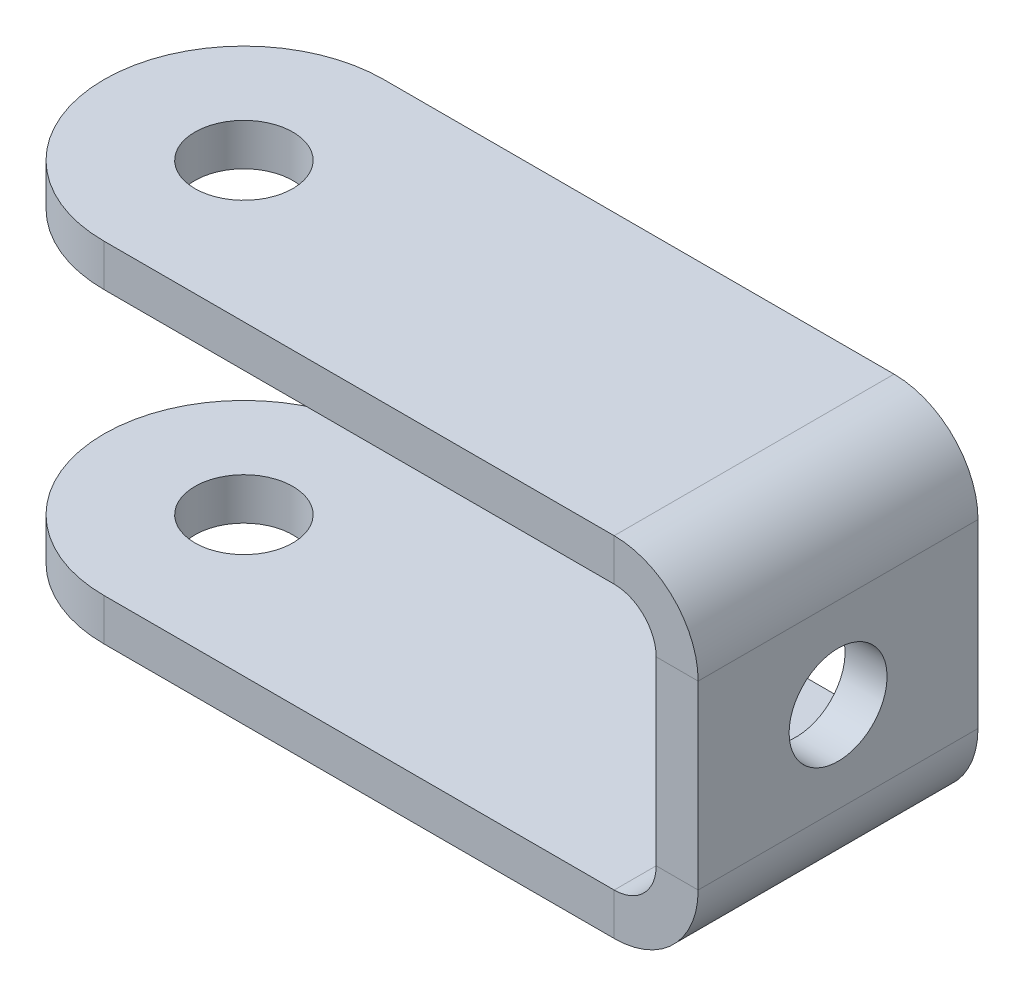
SolidWorks part; units mm, degrees
ref_plane "Front" through (0, 0, 0) normal (0, 0, 1) x (1, 0, 0)
ref_plane "Top" through (0, 0, 0) normal (0, 1, 0) x (1, 0, 0)
ref_plane "Right" through (0, 0, 0) normal (1, 0, 0) x (0, 0, -1)
sketch "Sketch1" plane through (0, 0, 0) normal (0, 1, 0) x (1, 0, 0)
  line L1 (0, 0) -> (50, 0)
  line L3 (0, 10) -> (50, 10)
  circle A0 centre (25, 5) radius 1.75
  circle A1 centre (0, 5) radius 1.75
  circle A2 centre (50, 5) radius 1.75
  arc A3 (0, 10) -> (0, 0) centre (0, 5) ccw
  arc A4 (50, 0) -> (50, 10) centre (50, 5) ccw
sheet metal parameters "Sheet-Metal1" thickness 1.5 parameters "D1"=1.5
base flange "Base-Flange1" sketch "Sketch1" thickness 1.5 reverse thickness direction yes parameters "D1"=1.5
sketch "Sketch3" plane through (0, 1.5, 0) normal (0, 1, 0) x (-1, 0, 0)
  line L1 (-30, 1.8718) -> (-30, -13.6482)
  line L2 (-20, 2.3393) -> (-20, -13.6482)
sketched bend "Sketched Bend1" parameters "D1"=0
bend "SketchBend1" bend radius 1.5 bend angle 90 parameters "D5"=1
bend "SketchBend2" bend radius 1.5 bend angle 90 parameters "D5"=2
flat pattern "Flat-Pattern1"
sketch "Bend-Lines1" plane through (0, 1.5, 0) normal (0, 1, 0) x (-1, 0, 0)
  line L0 (-20, -10) -> (-20, 0) construction
  line L1 (-30, -10) -> (-30, 0) construction
bend of the flat pattern "Flatten-<SketchBend1>1"
bend of the flat pattern "Flatten-<SketchBend2>1"
